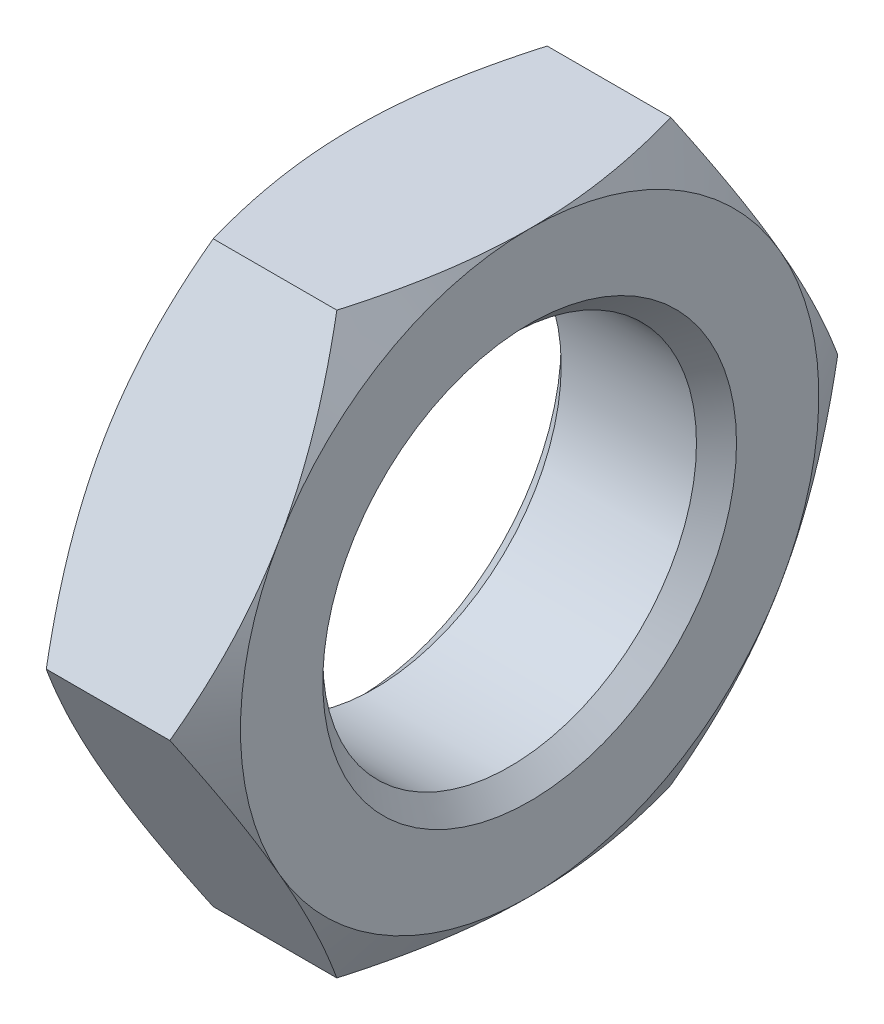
SolidWorks part; units mm, degrees
ref_plane "Front Plane" through (0, 0, 0) normal (0, 0, 1) x (1, 0, 0)
ref_plane "Top Plane" through (0, 0, 0) normal (0, 1, 0) x (1, 0, 0)
ref_plane "Right Plane" through (0, 0, 0) normal (1, 0, 0) x (0, 0, -1)
sketch "Sketch1" plane through (0, 0, 0) normal (1, 0, 0) x (0, 0, -1)
  line L1 (18.7639, 32.5) -> (-18.7639, 32.5)
  line L2 (-18.7639, 32.5) -> (-37.5278, 0)
  line L3 (-37.5278, 0) -> (-18.7639, -32.5)
  line L4 (-18.7639, -32.5) -> (18.7639, -32.5)
  line L5 (18.7639, -32.5) -> (37.5278, 0)
  line L6 (37.5278, 0) -> (18.7639, 32.5)
  circle A0 centre (0, 0) radius 32.5 construction
  circle A1 centre (0, 0) radius 21
extrude "Extrude1" add sketch "Sketch1" along normal blind 19.7
sketch "Sketch2" plane through (0, 0, 0) normal (0, 0, 1) x (1, 0, 0)
  line L0 (19.7, 32.5) -> (19.7, 130)
  line L1 (19.7, 130) -> (0, 130)
  line L2 (0, 130) -> (0, 32.5)
  line L3 (0, 32.5) -> (9.85, 49.5607)
  line L4 (9.85, 49.5607) -> (19.7, 32.5)
revolve "Cut-Revolve1" cut sketch "Sketch2" angle 360 about axis through (19.7, 0, 0) along (-1, 0, 0)
chamfer "Chamfer1" distance 2.25 angle 45 2 edges at (0, 0, -21) (19.7, 0, -21)
equation "\"D2@Sketch2\"=\"D1@Sketch1\"*2"
